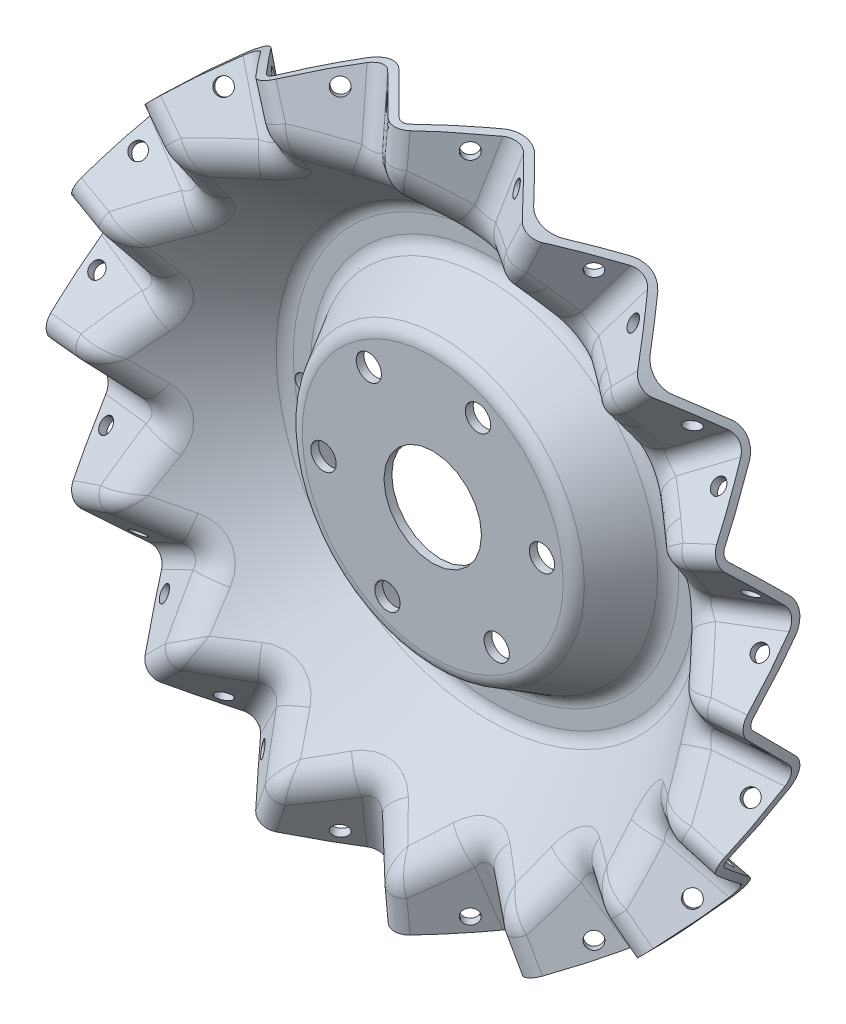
SolidWorks part; units mm, degrees
ref_plane "前视基准面" through (0, 0, 0) normal (0, 0, 1) x (1, 0, 0)
ref_plane "上视基准面" through (0, 0, 0) normal (0, 1, 0) x (1, 0, 0)
ref_plane "右视基准面" through (0, 0, 0) normal (1, 0, 0) x (0, 0, -1)
imported_body "输入3"
imported_body "曲面-输入1"
ref_plane "基准面4" through (26.1505, 63.1328, -6.2868) normal (-0.3811, -0.92, 0.0916) x (0.9239, -0.3827, 0)
sketch "草图1" plane through (26.1505, 63.1328, -6.2868) normal (-0.3811, -0.92, 0.0916) x (0.9239, -0.3827, 0)
  line L0 (0, 28.2904) -> (-2.2403, 26.0595)
  line L1 (2.2403, 26.0595) -> (0, 28.2904)
  arc A0 (-2.2403, 26.0595) -> (2.2403, 26.0595) centre (0, 23.8097) cw
extrude "切除-拉伸1" cut sketch "草图1" against normal up to surface
imported_body "曲面-输入2"
ref_plane "基准面5" through (48.3198, 48.3198, -6.2868) normal (-0.7041, -0.7041, 0.0916) x (0.7071, -0.7071, 0)
sketch "草图2" plane through (48.3198, 48.3198, -6.2868) normal (-0.7041, -0.7041, 0.0916) x (0.7071, -0.7071, 0)
  line L0 (0, 28.2904) -> (-2.2403, 26.0595)
  line L1 (2.2403, 26.0595) -> (0, 28.2904)
  arc A0 (-2.2403, 26.0595) -> (2.2403, 26.0595) centre (0, 23.8097) cw
extrude "切除-拉伸2" cut sketch "草图2" against normal up to surface
imported_body "曲面-输入3"
ref_plane "基准面6" through (0, -68.3345, -6.2868) normal (0, 0.9958, 0.0916) x (-1, 0, 0)
sketch "草图3" plane through (0, -68.3345, -6.2868) normal (0, 0.9958, 0.0916) x (-1, 0, 0)
  line L0 (0, 28.2904) -> (-2.2403, 26.0595)
  line L1 (2.2403, 26.0595) -> (0, 28.2904)
  arc A0 (-2.2403, 26.0595) -> (2.2403, 26.0595) centre (0, 23.8097) cw
extrude "切除-拉伸3" cut sketch "草图3" against normal up to surface
imported_body "曲面-输入4"
ref_plane "基准面7" through (-48.3198, -48.3198, -6.2868) normal (0.7041, 0.7041, 0.0916) x (-0.7071, 0.7071, 0)
sketch "草图4" plane through (-48.3198, -48.3198, -6.2868) normal (0.7041, 0.7041, 0.0916) x (-0.7071, 0.7071, 0)
  line L0 (0, 28.2904) -> (-2.2403, 26.0595)
  line L1 (2.2403, 26.0595) -> (0, 28.2904)
  arc A0 (-2.2403, 26.0595) -> (2.2403, 26.0595) centre (0, 23.8097) cw
extrude "切除-拉伸4" cut sketch "草图4" against normal up to surface
imported_body "曲面-输入5"
ref_plane "基准面8" through (-26.1505, 63.1328, -6.2868) normal (0.3811, -0.92, 0.0916) x (0.9239, 0.3827, 0)
sketch "草图5" plane through (-26.1505, 63.1328, -6.2868) normal (0.3811, -0.92, 0.0916) x (0.9239, 0.3827, 0)
  line L0 (0, 28.2904) -> (-2.2403, 26.0595)
  line L1 (2.2403, 26.0595) -> (0, 28.2904)
  arc A0 (-2.2403, 26.0595) -> (2.2403, 26.0595) centre (0, 23.8097) cw
extrude "切除-拉伸5" cut sketch "草图5" against normal up to surface
imported_body "曲面-输入6"
ref_plane "基准面9" through (63.1328, 26.1505, -6.2868) normal (-0.92, -0.3811, 0.0916) x (0.3827, -0.9239, 0)
sketch "草图6" plane through (63.1328, 26.1505, -6.2868) normal (-0.92, -0.3811, 0.0916) x (0.3827, -0.9239, 0)
  line L0 (0, 28.2904) -> (-2.2403, 26.0595)
  line L1 (2.2403, 26.0595) -> (0, 28.2904)
  arc A0 (-2.2403, 26.0595) -> (2.2403, 26.0595) centre (0, 23.8097) cw
extrude "切除-拉伸6" cut sketch "草图6" against normal up to surface
imported_body "曲面-输入7"
ref_plane "基准面10" through (48.3198, -48.3198, -6.2868) normal (-0.7041, 0.7041, 0.0916) x (-0.7071, -0.7071, 0)
sketch "草图7" plane through (48.3198, -48.3198, -6.2868) normal (-0.7041, 0.7041, 0.0916) x (-0.7071, -0.7071, 0)
  line L0 (0, 28.2904) -> (-2.2403, 26.0595)
  line L1 (2.2403, 26.0595) -> (0, 28.2904)
  arc A0 (-2.2403, 26.0595) -> (2.2403, 26.0595) centre (0, 23.8097) cw
extrude "切除-拉伸7" cut sketch "草图7" against normal up to surface
sketch "草图8" plane through (0, 0, 0) normal (0, 0, 1) x (1, 0, 0)
  circle A0 centre (0, 0) radius 35.9073
extrude "凸台-拉伸1" add sketch "草图8" along normal blind 12.7 draft 30
sketch "草图9" plane through (0, 0, -1.6002) normal (0, 0, -1) x (-1, 0, 0)
  circle A0 centre (0, 0) radius 34.9835
extrude "切除-拉伸8" cut sketch "草图9" against normal blind 12.7 draft 30
sketch "草图10" plane through (0, 0, 11.0998) normal (0, 0, -1) x (-1, 0, 0)
  circle A0 centre (0, 0) radius 10
  dimension "D1" = 20
extrude "切除-拉伸9" cut sketch "草图10" against normal through all
hole_wizard "孔1" positions "草图12" profile "草图11" legacy
sketch "草图12" plane through (0, 0, 0) normal (0, 0, 1) x (1, 0, 0)
  line L0 (-39.3098, -3.8717) -> (39.3098, 3.8717) construction
  circle A0 centre (0, 0) radius 39.5 construction
  point P0 (-39.3098, -3.8717)
  point P1 (39.3098, 3.8717)
  dimension "D1" = 79
sketch "草图11" plane through (-39.3098, -3.8717, 0) normal (1, 0, 0) x (0, -1, 0)
  line L0 (0, 0) -> (0, 1.6031)
  line L1 (0, 1.6031) -> (1.6, 1.6031)
  line L2 (1.6, 1.6031) -> (1.6, 0)
  line L3 (1.6, 0) -> (0, 0)
  line L4 (0, 110) -> (0, -10) construction
  dimension "直径" = 3.2
  dimension "深度" = 1.6031
hole_wizard "孔2" positions "草图14" profile "草图13" legacy
sketch "草图14" plane through (6.0873, 11.5669, 13.016) normal (-0.33, -0.6271, -0.7056) x (-0.944, 0.2192, 0.2467)
  point P0 (-62.9773, -22.5388)
sketch "草图13" plane through (65.5366, -19.086, 12.4531) normal (0.5103, 0.5103, -0.6922) x (-0.7941, 0.5885, -0.1516)
  line L0 (0, 0) -> (0, 66.6989)
  line L1 (0, 66.6989) -> (1.6, 66.6989)
  line L2 (1.6, 66.6989) -> (1.6, 0)
  line L3 (1.6, 0) -> (0, 0)
  line L4 (0, 110) -> (0, -10) construction
  dimension "直径" = 3.2
  dimension "深度" = 66.6989
hole_wizard "孔3" positions "草图16" profile "草图15" legacy
sketch "草图16" plane through (1.1975, -13.016, 13.016) normal (-0.0649, 0.7056, -0.7056) x (-0.9979, -0.0459, 0.0459)
  point P0 (-66.7953, 3.5401)
sketch "草图15" plane through (67.8518, -7.4466, 12.4531) normal (0.595, 0.595, 0.5403) x (-0.8011, 0.3848, 0.4585)
  line L0 (0, 0) -> (0, 53.3736)
  line L1 (0, 53.3736) -> (1.5875, 53.3736)
  line L2 (1.5875, 53.3736) -> (1.5875, 0)
  line L3 (1.5875, 0) -> (0, 0)
  line L4 (0, 110) -> (0, -10) construction
  dimension "直径" = 3.175
  dimension "深度" = 53.3736
hole_wizard "孔4" positions "草图18" profile "草图17" legacy
sketch "草图18" plane through (1.1975, 13.016, 13.016) normal (-0.0649, -0.7056, -0.7056) x (-0.9979, 0.0459, 0.0459)
  point P0 (-66.7953, -3.5401)
sketch "草图17" plane through (67.8518, 7.4466, 12.4531) normal (0.5597, 0.5597, -0.6112) x (-0.8262, 0.4346, -0.3586)
  line L0 (0, 0) -> (0, 53.3736)
  line L1 (0, 53.3736) -> (1.6, 53.3736)
  line L2 (1.6, 53.3736) -> (1.6, 0)
  line L3 (1.6, 0) -> (0, 0)
  line L4 (0, 110) -> (0, -10) construction
  dimension "直径" = 3.2
  dimension "深度" = 53.3736
hole_wizard "孔5" positions "草图20" profile "草图19" legacy
sketch "草图20" plane through (6.0873, -11.5669, 13.016) normal (-0.33, 0.6271, -0.7056) x (-0.944, -0.2192, 0.2467)
  point P0 (-62.9773, 22.5388)
sketch "草图19" plane through (65.5366, 19.086, 12.4531) normal (0.6777, 0.6777, 0.2853) x (-0.6571, 0.3841, 0.6486)
  line L0 (0, 0) -> (0, 66.6989)
  line L1 (0, 66.6989) -> (1.5875, 66.6989)
  line L2 (1.5875, 66.6989) -> (1.5875, 0)
  line L3 (1.5875, 0) -> (0, 0)
  line L4 (0, 110) -> (0, -10) construction
  dimension "直径" = 3.175
  dimension "深度" = 66.6989
hole_wizard "孔6" positions "草图22" profile "草图21" legacy
sketch "草图22" plane through (-3.8747, 12.4834, 13.016) normal (0.2101, -0.6767, -0.7056) x (-0.9777, -0.1454, -0.1516)
  point P0 (-65.1657, 15.0853)
sketch "草图21" plane through (59.8372, 32.8456, 12.4531) normal (0.6405, 0.6405, -0.4236) x (-0.7387, 0.363, -0.568)
  line L0 (0, 0) -> (0, 61.6794)
  line L1 (0, 61.6794) -> (1.5875, 61.6794)
  line L2 (1.5875, 61.6794) -> (1.5875, 0)
  line L3 (1.5875, 0) -> (0, 0)
  line L4 (0, 110) -> (0, -10) construction
  dimension "直径" = 3.175
  dimension "深度" = 61.6794
hole_wizard "孔7" positions "草图24" profile "草图23" legacy
sketch "草图24" plane through (10.0504, -8.3569, 13.016) normal (-0.5448, 0.453, -0.7056) x (-0.8385, -0.2944, 0.4585)
  point P0 (-51.5109, 42.6705)
sketch "草图23" plane through (53.244, 42.7129, 12.4531) normal (0.7041, 0.7041, -0.0916) x (-0.4553, 0.5468, 0.7026)
  line L0 (0, 0) -> (0, 69.6155)
  line L1 (0, 69.6155) -> (1.6, 69.6155)
  line L2 (1.6, 69.6155) -> (1.6, 0)
  line L3 (1.6, 0) -> (0, 0)
  line L4 (0, 110) -> (0, -10) construction
  dimension "直径" = 3.2
  dimension "深度" = 69.6155
hole_wizard "孔8" positions "草图26" profile "草图25" legacy
sketch "草图26" plane through (-8.3569, 10.0504, 13.016) normal (0.453, -0.5448, -0.7056) x (-0.8915, -0.2769, -0.3586)
  point P0 (-57.286, 34.5318)
sketch "草图25" plane through (42.7129, 53.244, 12.4531) normal (0.7041, 0.7041, -0.0916) x (-0.5468, 0.4553, -0.7026)
  line L0 (0, 0) -> (0, 69.6155)
  line L1 (0, 69.6155) -> (1.5875, 69.6155)
  line L2 (1.5875, 69.6155) -> (1.5875, 0)
  line L3 (1.5875, 0) -> (0, 0)
  line L4 (0, 110) -> (0, -10) construction
  dimension "直径" = 3.175
  dimension "深度" = 69.6155
hole_wizard "孔9" positions "草图28" profile "草图27" legacy
sketch "草图28" plane through (12.4834, -3.8747, 13.016) normal (-0.6767, 0.2101, -0.7056) x (-0.7362, -0.1931, 0.6486)
  point P0 (-27.6578, 60.9031)
sketch "草图27" plane through (32.8456, 59.8372, 12.4531) normal (0.6405, 0.6405, -0.4236) x (-0.363, 0.7387, 0.568)
  line L0 (0, 0) -> (0, 61.6794)
  line L1 (0, 61.6794) -> (1.5875, 61.6794)
  line L2 (1.5875, 61.6794) -> (1.5875, 0)
  line L3 (1.5875, 0) -> (0, 0)
  line L4 (0, 110) -> (0, -10) construction
  dimension "直径" = 3.175
  dimension "深度" = 61.6794
hole_wizard "孔10" positions "草图30" profile "草图29" legacy
sketch "草图30" plane through (-11.5669, 6.0873, 13.016) normal (0.6271, -0.33, -0.7056) x (-0.779, -0.2656, -0.568)
  point P0 (-39.3506, 54.0895)
sketch "草图29" plane through (19.086, 65.5366, 12.4531) normal (0.6777, 0.6777, 0.2853) x (-0.3841, 0.6571, -0.6486)
  line L0 (0, 0) -> (0, 66.6989)
  line L1 (0, 66.6989) -> (1.6, 66.6989)
  line L2 (1.6, 66.6989) -> (1.6, 0)
  line L3 (1.6, 0) -> (0, 0)
  line L4 (0, 110) -> (0, -10) construction
  dimension "直径" = 3.2
  dimension "深度" = 66.6989
hole_wizard "孔11" positions "草图32" profile "草图31" legacy
sketch "草图32" plane through (13.016, 1.1975, 13.016) normal (-0.7056, -0.0649, -0.7056) x (-0.7086, 0.0646, 0.7026)
  point P0 (7.8597, 66.4256)
sketch "草图31" plane through (7.4466, 67.8518, 12.4531) normal (0.5597, 0.5597, -0.6112) x (-0.4346, 0.8262, 0.3586)
  line L0 (0, 0) -> (0, 53.3736)
  line L1 (0, 53.3736) -> (1.6, 53.3736)
  line L2 (1.6, 53.3736) -> (1.6, 0)
  line L3 (1.6, 0) -> (0, 0)
  line L4 (0, 110) -> (0, -10) construction
  dimension "直径" = 3.2
  dimension "深度" = 53.3736
hole_wizard "孔12" positions "草图34" profile "草图33" legacy
sketch "草图34" plane through (-13.016, 1.1975, 13.016) normal (0.7056, -0.0649, -0.7056) x (-0.7086, -0.0646, -0.7026)
  point P0 (-7.8597, 66.4256)
sketch "草图33" plane through (-7.4466, 67.8518, 12.4531) normal (0.595, 0.595, 0.5403) x (-0.3848, 0.8011, -0.4585)
  line L0 (0, 0) -> (0, 53.3736)
  line L1 (0, 53.3736) -> (1.6, 53.3736)
  line L2 (1.6, 53.3736) -> (1.6, 0)
  line L3 (1.6, 0) -> (0, 0)
  line L4 (0, 110) -> (0, -10) construction
  dimension "直径" = 3.2
  dimension "深度" = 53.3736
hole_wizard "孔13" positions "草图36" profile "草图35" legacy
sketch "草图36" plane through (11.5669, 6.0873, 13.016) normal (-0.6271, -0.33, -0.7056) x (-0.779, 0.2656, 0.568)
  point P0 (39.3506, 54.0895)
sketch "草图35" plane through (-19.086, 65.5366, 12.4531) normal (0.5103, 0.5103, -0.6922) x (-0.5885, 0.7941, 0.1516)
  line L0 (0, 0) -> (0, 66.6989)
  line L1 (0, 66.6989) -> (1.6, 66.6989)
  line L2 (1.6, 66.6989) -> (1.6, 0)
  line L3 (1.6, 0) -> (0, 0)
  line L4 (0, 110) -> (0, -10) construction
  dimension "直径" = 3.2
  dimension "深度" = 66.6989
hole_wizard "孔14" positions "草图38" profile "草图37" legacy
sketch "草图38" plane through (-12.4834, -3.8747, 13.016) normal (0.6767, 0.2101, -0.7056) x (-0.7362, 0.1931, -0.6486)
  point P0 (27.6578, 60.9031)
sketch "草图37" plane through (-32.8456, 59.8372, 12.4531) normal (0.5286, 0.5286, 0.6643) x (-0.5125, 0.8225, -0.2467)
  line L0 (0, 0) -> (0, 61.6794)
  line L1 (0, 61.6794) -> (1.6, 61.6794)
  line L2 (1.6, 61.6794) -> (1.6, 0)
  line L3 (1.6, 0) -> (0, 0)
  line L4 (0, 110) -> (0, -10) construction
  dimension "直径" = 3.2
  dimension "深度" = 61.6794
hole_wizard "孔15" positions "草图40" profile "草图39" legacy
sketch "草图40" plane through (8.3569, 10.0504, 13.016) normal (-0.453, -0.5448, -0.7056) x (-0.8915, 0.2769, 0.3586)
  point P0 (57.286, 34.5318)
sketch "草图39" plane through (-42.7129, 53.244, 12.4531) normal (0.5, 0.5, -0.7071) x (-0.7381, 0.6732, -0.0459)
  line L0 (0, 0) -> (0, 69.6155)
  line L1 (0, 69.6155) -> (1.6, 69.6155)
  line L2 (1.6, 69.6155) -> (1.6, 0)
  line L3 (1.6, 0) -> (0, 0)
  line L4 (0, 110) -> (0, -10) construction
  dimension "直径" = 3.2
  dimension "深度" = 69.6155
hole_wizard "孔16" positions "草图42" profile "草图41" legacy
sketch "草图42" plane through (-10.0504, -8.3569, 13.016) normal (0.5448, 0.453, -0.7056) x (-0.8385, 0.2944, -0.4585)
  point P0 (51.5109, 42.6705)
sketch "草图41" plane through (-53.244, 42.7129, 12.4531) normal (0.5, 0.5, 0.7071) x (-0.6732, 0.7381, -0.0459)
  line L0 (0, 0) -> (0, 69.6155)
  line L1 (0, 69.6155) -> (1.6, 69.6155)
  line L2 (1.6, 69.6155) -> (1.6, 0)
  line L3 (1.6, 0) -> (0, 0)
  line L4 (0, 110) -> (0, -10) construction
  dimension "直径" = 3.2
  dimension "深度" = 69.6155
hole_wizard "孔17" positions "草图44" profile "草图43" legacy
sketch "草图44" plane through (3.8747, 12.4834, 13.016) normal (-0.2101, -0.6767, -0.7056) x (-0.9777, 0.1454, 0.1516)
  point P0 (65.1657, 15.0853)
sketch "草图43" plane through (-59.8372, 32.8456, 12.4531) normal (0.5286, 0.5286, -0.6643) x (-0.8225, 0.5125, -0.2467)
  line L0 (0, 0) -> (0, 61.6794)
  line L1 (0, 61.6794) -> (1.6, 61.6794)
  line L2 (1.6, 61.6794) -> (1.6, 0)
  line L3 (1.6, 0) -> (0, 0)
  line L4 (0, 110) -> (0, -10) construction
  dimension "直径" = 3.2
  dimension "深度" = 61.6794
hole_wizard "孔18" positions "草图46" profile "草图45" legacy
sketch "草图46" plane through (-6.0873, -11.5669, 13.016) normal (0.33, 0.6271, -0.7056) x (-0.944, 0.2192, -0.2467)
  point P0 (62.9773, 22.5388)
sketch "草图45" plane through (-65.5366, 19.086, 12.4531) normal (0.5103, 0.5103, 0.6922) x (-0.7941, 0.5885, 0.1516)
  line L0 (0, 0) -> (0, 66.6989)
  line L1 (0, 66.6989) -> (1.6, 66.6989)
  line L2 (1.6, 66.6989) -> (1.6, 0)
  line L3 (1.6, 0) -> (0, 0)
  line L4 (0, 110) -> (0, -10) construction
  dimension "直径" = 3.2
  dimension "深度" = 66.6989
hole_wizard "孔19" positions "草图48" profile "草图47" legacy
sketch "草图48" plane through (-1.1975, 13.016, 13.016) normal (0.0649, -0.7056, -0.7056) x (-0.9979, -0.0459, -0.0459)
  point P0 (66.7953, -3.5401)
sketch "草图47" plane through (-67.8518, 7.4466, 12.4531) normal (0.595, 0.595, -0.5403) x (-0.8011, 0.3848, -0.4585)
  line L0 (0, 0) -> (0, 53.3736)
  line L1 (0, 53.3736) -> (1.6, 53.3736)
  line L2 (1.6, 53.3736) -> (1.6, 0)
  line L3 (1.6, 0) -> (0, 0)
  line L4 (0, 110) -> (0, -10) construction
  dimension "直径" = 3.2
  dimension "深度" = 53.3736
hole_wizard "孔20" positions "草图50" profile "草图49" legacy
sketch "草图50" plane through (-1.1975, -13.016, 13.016) normal (0.0649, 0.7056, -0.7056) x (-0.9979, 0.0459, -0.0459)
  point P0 (66.7953, 3.5401)
sketch "草图49" plane through (-67.8518, -7.4466, 12.4531) normal (0.5597, 0.5597, 0.6112) x (-0.8262, 0.4346, 0.3586)
  line L0 (0, 0) -> (0, 53.3736)
  line L1 (0, 53.3736) -> (1.6, 53.3736)
  line L2 (1.6, 53.3736) -> (1.6, 0)
  line L3 (1.6, 0) -> (0, 0)
  line L4 (0, 110) -> (0, -10) construction
  dimension "直径" = 3.2
  dimension "深度" = 53.3736
hole_wizard "孔21" positions "草图52" profile "草图51" legacy
sketch "草图52" plane through (-6.0873, 11.5669, 13.016) normal (0.33, -0.6271, -0.7056) x (-0.944, -0.2192, -0.2467)
  point P0 (62.9773, -22.5388)
sketch "草图51" plane through (-65.5366, -19.086, 12.4531) normal (0.6777, 0.6777, -0.2853) x (-0.6571, 0.3841, -0.6486)
  line L0 (0, 0) -> (0, 66.6989)
  line L1 (0, 66.6989) -> (1.6, 66.6989)
  line L2 (1.6, 66.6989) -> (1.6, 0)
  line L3 (1.6, 0) -> (0, 0)
  line L4 (0, 110) -> (0, -10) construction
  dimension "直径" = 3.2
  dimension "深度" = 66.6989
hole_wizard "孔22" positions "草图54" profile "草图53" legacy
sketch "草图54" plane through (3.8747, -12.4834, 13.016) normal (-0.2101, 0.6767, -0.7056) x (-0.9777, -0.1454, 0.1516)
  point P0 (65.1657, -15.0853)
sketch "草图53" plane through (-59.8372, -32.8456, 12.4531) normal (0.6405, 0.6405, 0.4236) x (-0.7387, 0.363, 0.568)
  line L0 (0, 0) -> (0, 61.6794)
  line L1 (0, 61.6794) -> (1.6, 61.6794)
  line L2 (1.6, 61.6794) -> (1.6, 0)
  line L3 (1.6, 0) -> (0, 0)
  line L4 (0, 110) -> (0, -10) construction
  dimension "直径" = 3.2
  dimension "深度" = 61.6794
hole_wizard "孔23" positions "草图56" profile "草图55" legacy
sketch "草图56" plane through (-10.0504, 8.3569, 13.016) normal (0.5448, -0.453, -0.7056) x (-0.8385, -0.2944, -0.4585)
  point P0 (51.5109, -42.6705)
sketch "草图55" plane through (-53.244, -42.7129, 12.4531) normal (0.7041, 0.7041, 0.0916) x (-0.4553, 0.5468, -0.7026)
  line L0 (0, 0) -> (0, 69.6155)
  line L1 (0, 69.6155) -> (1.6, 69.6155)
  line L2 (1.6, 69.6155) -> (1.6, 0)
  line L3 (1.6, 0) -> (0, 0)
  line L4 (0, 110) -> (0, -10) construction
  dimension "直径" = 3.2
  dimension "深度" = 69.6155
hole_wizard "孔24" positions "草图58" profile "草图57" legacy
sketch "草图58" plane through (8.3569, -10.0504, 13.016) normal (-0.453, 0.5448, -0.7056) x (-0.8915, -0.2769, 0.3586)
  point P0 (57.286, -34.5318)
sketch "草图57" plane through (-42.7129, -53.244, 12.4531) normal (0.7041, 0.7041, 0.0916) x (-0.5468, 0.4553, 0.7026)
  line L0 (0, 0) -> (0, 69.6155)
  line L1 (0, 69.6155) -> (1.6, 69.6155)
  line L2 (1.6, 69.6155) -> (1.6, 0)
  line L3 (1.6, 0) -> (0, 0)
  line L4 (0, 110) -> (0, -10) construction
  dimension "直径" = 3.2
  dimension "深度" = 69.6155
hole_wizard "孔25" positions "草图60" profile "草图59" legacy
sketch "草图60" plane through (-12.4834, 3.8747, 13.016) normal (0.6767, -0.2101, -0.7056) x (-0.7362, -0.1931, -0.6486)
  point P0 (27.6578, -60.9031)
sketch "草图59" plane through (-32.8456, -59.8372, 12.4531) normal (0.6405, 0.6405, 0.4236) x (-0.363, 0.7387, -0.568)
  line L0 (0, 0) -> (0, 61.6794)
  line L1 (0, 61.6794) -> (1.6, 61.6794)
  line L2 (1.6, 61.6794) -> (1.6, 0)
  line L3 (1.6, 0) -> (0, 0)
  line L4 (0, 110) -> (0, -10) construction
  dimension "直径" = 3.2
  dimension "深度" = 61.6794
hole_wizard "孔26" positions "草图62" profile "草图61" legacy
sketch "草图62" plane through (11.5669, -6.0873, 13.016) normal (-0.6271, 0.33, -0.7056) x (-0.779, -0.2656, 0.568)
  point P0 (39.3506, -54.0895)
sketch "草图61" plane through (-19.086, -65.5366, 12.4531) normal (0.6777, 0.6777, -0.2853) x (-0.3841, 0.6571, 0.6486)
  line L0 (0, 0) -> (0, 66.6989)
  line L1 (0, 66.6989) -> (1.6, 66.6989)
  line L2 (1.6, 66.6989) -> (1.6, 0)
  line L3 (1.6, 0) -> (0, 0)
  line L4 (0, 110) -> (0, -10) construction
  dimension "直径" = 3.2
  dimension "深度" = 66.6989
hole_wizard "孔27" positions "草图64" profile "草图63" legacy
sketch "草图64" plane through (-13.016, -1.1975, 13.016) normal (0.7056, 0.0649, -0.7056) x (-0.7086, 0.0646, -0.7026)
  point P0 (-7.8597, -66.4256)
sketch "草图63" plane through (-7.4466, -67.8518, 12.4531) normal (0.5597, 0.5597, 0.6112) x (-0.4346, 0.8262, -0.3586)
  line L0 (0, 0) -> (0, 53.3736)
  line L1 (0, 53.3736) -> (1.6, 53.3736)
  line L2 (1.6, 53.3736) -> (1.6, 0)
  line L3 (1.6, 0) -> (0, 0)
  line L4 (0, 110) -> (0, -10) construction
  dimension "直径" = 3.2
  dimension "深度" = 53.3736
hole_wizard "孔28" positions "草图66" profile "草图65" legacy
sketch "草图66" plane through (13.016, -1.1975, 13.016) normal (-0.7056, 0.0649, -0.7056) x (-0.7086, -0.0646, 0.7026)
  point P0 (7.8597, -66.4256)
sketch "草图65" plane through (7.4466, -67.8518, 12.4531) normal (0.595, 0.595, -0.5403) x (-0.3848, 0.8011, 0.4585)
  line L0 (0, 0) -> (0, 53.3736)
  line L1 (0, 53.3736) -> (1.6, 53.3736)
  line L2 (1.6, 53.3736) -> (1.6, 0)
  line L3 (1.6, 0) -> (0, 0)
  line L4 (0, 110) -> (0, -10) construction
  dimension "直径" = 3.2
  dimension "深度" = 53.3736
hole_wizard "孔29" positions "草图68" profile "草图67" legacy
sketch "草图68" plane through (-11.5669, -6.0873, 13.016) normal (0.6271, 0.33, -0.7056) x (-0.779, 0.2656, -0.568)
  point P0 (-39.3506, -54.0895)
sketch "草图67" plane through (19.086, -65.5366, 12.4531) normal (0.5103, 0.5103, 0.6922) x (-0.5885, 0.7941, -0.1516)
  line L0 (0, 0) -> (0, 66.6989)
  line L1 (0, 66.6989) -> (1.6, 66.6989)
  line L2 (1.6, 66.6989) -> (1.6, 0)
  line L3 (1.6, 0) -> (0, 0)
  line L4 (0, 110) -> (0, -10) construction
  dimension "直径" = 3.2
  dimension "深度" = 66.6989
hole_wizard "孔30" positions "草图70" profile "草图69" legacy
sketch "草图70" plane through (12.4834, 3.8747, 13.016) normal (-0.6767, -0.2101, -0.7056) x (-0.7362, 0.1931, 0.6486)
  point P0 (-27.6578, -60.9031)
sketch "草图69" plane through (32.8456, -59.8372, 12.4531) normal (0.5286, 0.5286, -0.6643) x (-0.5125, 0.8225, 0.2467)
  line L0 (0, 0) -> (0, 61.6794)
  line L1 (0, 61.6794) -> (1.6, 61.6794)
  line L2 (1.6, 61.6794) -> (1.6, 0)
  line L3 (1.6, 0) -> (0, 0)
  line L4 (0, 110) -> (0, -10) construction
  dimension "直径" = 3.2
  dimension "深度" = 61.6794
hole_wizard "孔31" positions "草图72" profile "草图71" legacy
sketch "草图72" plane through (-8.3569, -10.0504, 13.016) normal (0.453, 0.5448, -0.7056) x (-0.8915, 0.2769, -0.3586)
  point P0 (-57.286, -34.5318)
sketch "草图71" plane through (42.7129, -53.244, 12.4531) normal (0.5, 0.5, 0.7071) x (-0.7381, 0.6732, 0.0459)
  line L0 (0, 0) -> (0, 69.6155)
  line L1 (0, 69.6155) -> (1.6, 69.6155)
  line L2 (1.6, 69.6155) -> (1.6, 0)
  line L3 (1.6, 0) -> (0, 0)
  line L4 (0, 110) -> (0, -10) construction
  dimension "直径" = 3.2
  dimension "深度" = 69.6155
hole_wizard "孔32" positions "草图74" profile "草图73" legacy
sketch "草图74" plane through (10.0504, 8.3569, 13.016) normal (-0.5448, -0.453, -0.7056) x (-0.8385, 0.2944, 0.4585)
  point P0 (-51.5109, -42.6705)
sketch "草图73" plane through (53.244, -42.7129, 12.4531) normal (0.5, 0.5, -0.7071) x (-0.6732, 0.7381, 0.0459)
  line L0 (0, 0) -> (0, 69.6155)
  line L1 (0, 69.6155) -> (1.6, 69.6155)
  line L2 (1.6, 69.6155) -> (1.6, 0)
  line L3 (1.6, 0) -> (0, 0)
  line L4 (0, 110) -> (0, -10) construction
  dimension "直径" = 3.2
  dimension "深度" = 69.6155
hole_wizard "孔33" positions "草图76" profile "草图75" legacy
sketch "草图76" plane through (-3.8747, -12.4834, 13.016) normal (0.2101, 0.6767, -0.7056) x (-0.9777, 0.1454, -0.1516)
  point P0 (-65.1657, -15.0853)
sketch "草图75" plane through (59.8372, -32.8456, 12.4531) normal (0.5286, 0.5286, 0.6643) x (-0.8225, 0.5125, 0.2467)
  line L0 (0, 0) -> (0, 61.6794)
  line L1 (0, 61.6794) -> (1.6, 61.6794)
  line L2 (1.6, 61.6794) -> (1.6, 0)
  line L3 (1.6, 0) -> (0, 0)
  line L4 (0, 110) -> (0, -10) construction
  dimension "直径" = 3.2
  dimension "深度" = 61.6794
hole_wizard "孔34" positions "草图78" profile "草图77" legacy
sketch "草图78" plane through (0, 0, 12.7) normal (0, 0, 1) x (1, 0, 0)
  line L0 (9.2859, 20.4944) -> (-9.2859, -20.4944) construction
  line L2 (-13.1057, 18.2891) -> (13.1057, -18.2891) construction
  line L4 (-22.3917, -2.2054) -> (22.3917, 2.2054) construction
  circle A0 centre (0, 0) radius 22.5 construction
  point P0 (-13.1057, 18.2891)
  point P1 (-22.3917, -2.2054)
  point P2 (-9.2859, -20.4944)
  point P3 (13.1057, -18.2891)
  point P4 (22.3917, 2.2054)
  point P5 (9.2859, 20.4944)
  dimension "D1" = 45
sketch "草图77" plane through (-13.1057, 18.2891, 12.7) normal (1, 0, 0) x (0, -1, 0)
  line L0 (0, 0) -> (0, 14.3031)
  line L1 (0, 14.3031) -> (2.6, 14.3031)
  line L2 (2.6, 14.3031) -> (2.6, 0)
  line L3 (2.6, 0) -> (0, 0)
  line L4 (0, 110) -> (0, -10) construction
  dimension "直径" = 5.2
  dimension "深度" = 14.3031
fillet "圆角1" radius 3.175 18 edges at (0, -61.6549, 21.1533) (45.8397, -45.8397, 22.2707) (35.9073, 0, 0) (-45.8397, -45.8397, 22.2707) (28.575, 0, 12.7) (43.5966, 43.5966, 21.1533) (-24.8083, 59.8924, 22.2707) (23.5943, 56.9617, 21.1533) (59.8924, 24.8083, 22.2707) (34.7625, 52.0257, 10.557) (52.0257, 34.7625, 10.557)
fillet "圆角2" radius 4.7752 7 edges at (34.9835, 0, -1.6002) (34.9905, 44.6095, 14.1622) (27.8235, 49.3983, 14.1622) (27.8235, -49.3983, 14.1622) (34.9905, -44.6095, 14.1622) (34.8041, 52.0881, 8.2678) (34.8041, -52.0881, 8.2678)
fillet "圆角3" radius 6.35 6 edges at (27.4007, 49.9744, 17.007) (35.6845, 44.4393, 17.007) (30.5475, 45.1652, 14.0661) (49.9744, 27.4007, 17.007) (45.5062, 30.0372, 14.0661) (44.4393, 35.6845, 17.007)
other "删除面3"
other "删除面4"
